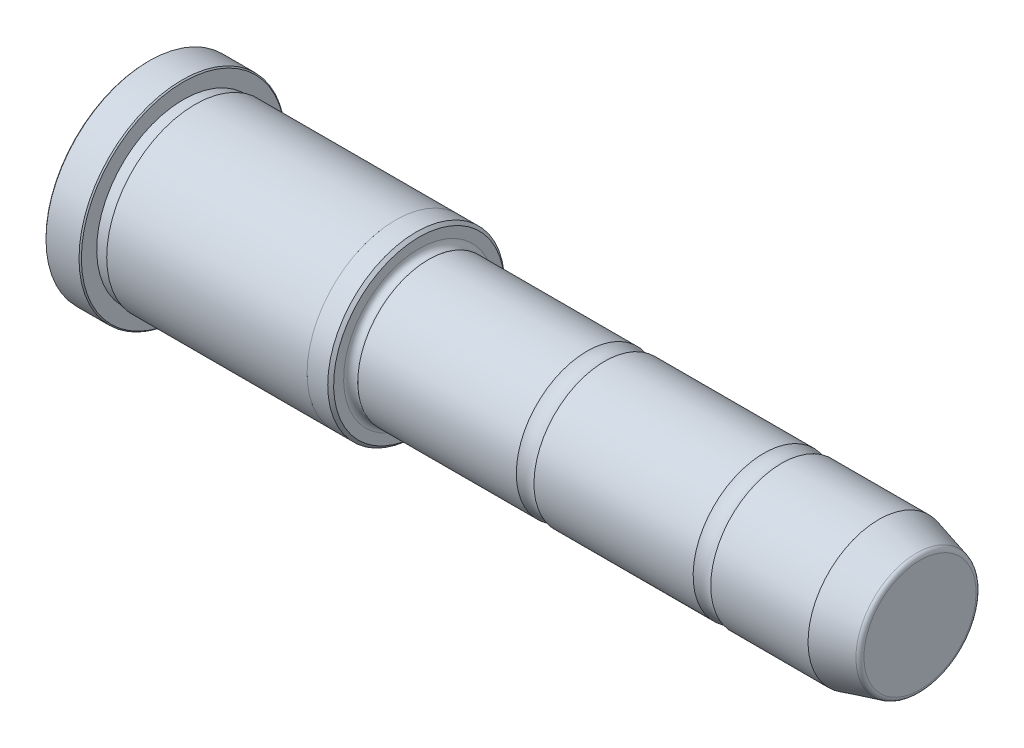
SolidWorks part; units mm, degrees
ref_plane "Front Plane" through (0, 0, 0) normal (0, 0, 1) x (1, 0, 0)
ref_plane "Top Plane" through (0, 0, 0) normal (0, 1, 0) x (1, 0, 0)
ref_plane "Right Plane" through (0, 0, 0) normal (1, 0, 0) x (0, 0, -1)
sketch "Sketch1" plane through (0, 0, 0) normal (0, 0, 1) x (1, 0, 0)
  line L0 (85, 10.1244) -> (78, 12)
  line L1 (78, 12) -> (1.6, 12)
  line L2 (0, 12.8) -> (0, 15)
  line L3 (0, 15) -> (-4, 15)
  line L4 (-38, 15.001) -> (-38, 14.7)
  line L5 (-38, 14.7) -> (-40, 14.7)
  line L6 (-40, 14.7) -> (-40, 17.5)
  line L7 (-40, 17.5) -> (-46, 17.5)
  line L8 (-46, 17.5) -> (-46, 0)
  line L9 (-38, 15.001) -> (-4, 15.001)
  line L10 (-4, 15.001) -> (-4, 15)
  line L13 (85, 10.1244) -> (85, 0)
  line L14 (85, 0) -> (-85, 0) construction
  line L15 (85, 0) -> (-46, 0)
  arc A0 (0, 12.8) -> (1.6, 12) centre (1, 12.8) ccw
  point P16 (0, 0)
  dimension "ShoulderRadii" = 2
  dimension "D1" = 15
  dimension "D2" = 0.3
  dimension "PinDia" = 24
  dimension "ChamferLeadIn" = 7
  dimension "ShoulderDia" = 30
  dimension "PinLengthN" = 85
  dimension "ShoulderLength" = 46
  dimension "D3" = 4
  dimension "ShoulderGap" = 2
  dimension "D4" = 0.001
  dimension "T" = 6
  dimension "HeadDia" = 35
  dimension "D8" = 0.2
revolve "Revolve1" add sketch "Sketch1" angle 360 about L14
sketch "Sketch2" plane through (0, 0, 0) normal (0, 0, 1) x (1, 0, 0)
  line L0 (85, -10.1244) -> (85, 10.1244) construction
  line L1 (1.6, 11.6) -> (78, 11.6) construction
  line L2 (78, 12) -> (1.6, 12) construction
  line L3 (1.6, 12) -> (1.6, -12) construction
  line L4 (58.5033, 12) -> (61.4967, 12)
  line L5 (78, 12) -> (78, -12) construction
  arc A0 (58.5033, 12) -> (61.4967, 12) centre (60, 14.6) ccw
  dimension "GrooveRadius" = 3
  dimension "D3" = 0.4
  dimension "AGroove" = 25
revolve "Groove A" cut sketch "Sketch2" angle 360 about axis through (85, 0, 0) along (1, 0, 0)
sketch "Sketch3" plane through (0, 0, 0) normal (0, 0, 1) x (1, 0, 0)
  line L3 (28.5033, 12) -> (31.4967, 12)
  arc A0 (28.5033, 12) -> (31.4967, 12) centre (30, 14.6) ccw
  arc A1 (58.5033, 12) -> (61.4967, 12) centre (60, 14.6) ccw construction
  dimension "D1" = 0.4
  dimension "GroovePitch" = 30
revolve "Groove B" cut sketch "Sketch3" angle 360 about axis through (85, 0, 0) along (1, 0, 0)
sketch "Sketch4" plane through (0, 0, 0) normal (0, 0, 1) x (1, 0, 0)
  line L2 (28.5033, 12) -> (1.6, 12) construction
  line L3 (-1.4967, 12) -> (1.4967, 12)
  arc A0 (-1.4967, 12) -> (1.4967, 12) centre (0, 14.6) ccw
  arc A3 (28.5033, 12) -> (31.4967, 12) centre (30, 14.6) ccw construction
  dimension "D1" = 0.4
revolve "Groove C" [suppressed] cut sketch "Sketch4" angle 360
sketch "Sketch5" [suppressed] plane through (0, 0, 0) normal (0, 0, 1) x (1, 0, 0)
  line L0 (24.5033, 12) -> (27.4967, 12)
  line L1 (62.5033, 12) -> (1.6, 12) construction
  arc A0 (24.5033, 12) -> (27.4967, 12) centre (26, 14.6) ccw
  arc A3 (62.5033, 12) -> (65.4967, 12) centre (64, 14.6) ccw construction
  dimension "D1" = 0.4
revolve "Groove D" [suppressed] cut sketch "Sketch5" angle 360
fillet "Fillet1" radius 0.8 1 edges at (85, 10.1244, 0)
chamfer "Chamfer1" distance 0.2 angle 45 2 edges at (-46, 17.5, 0) (-40, 17.5, 0)
chamfer "Chamfer2" distance 0.5 angle 45 1 edges at (0, 15, 0)
